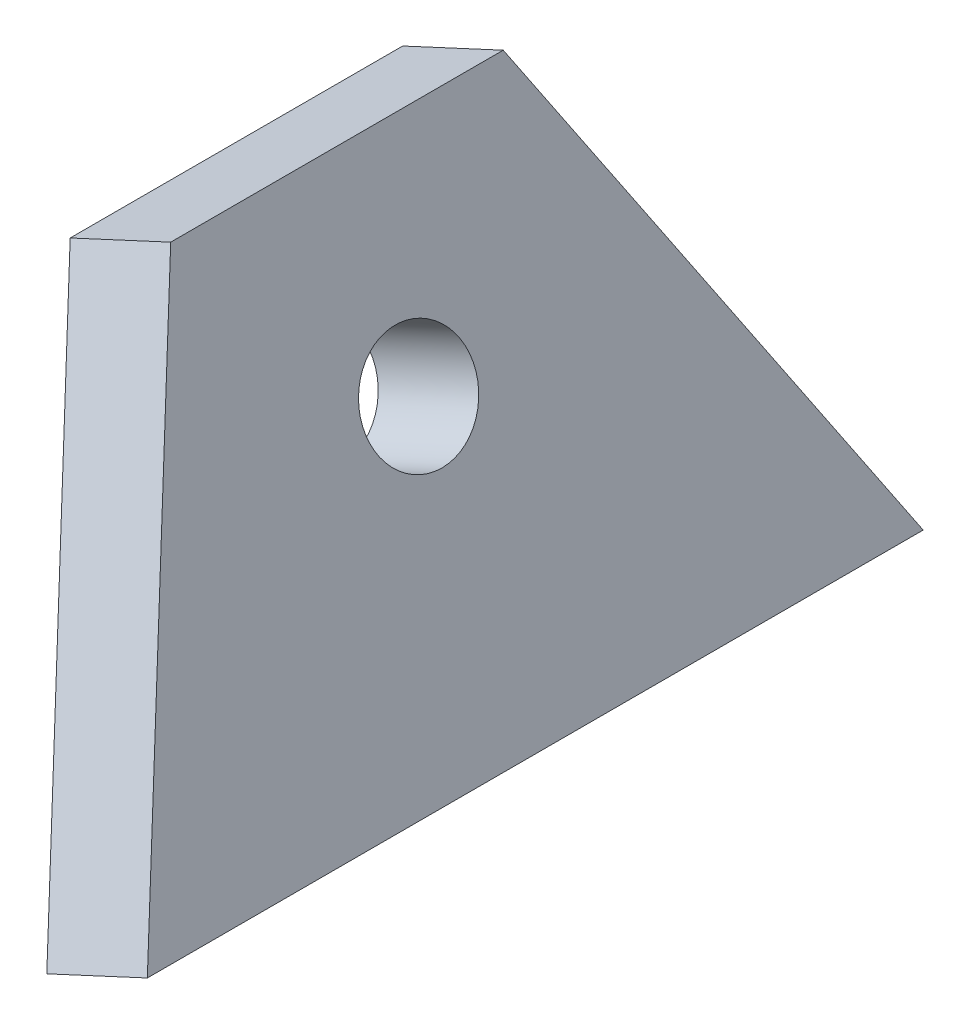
SolidWorks part; units mm, degrees
ref_plane "Alzado" through (0, 0, 0) normal (0, 0, 1) x (1, 0, 0)
ref_plane "Planta" through (0, 0, 0) normal (0, 1, 0) x (1, 0, 0)
ref_plane "Vista lateral" through (0, 0, 0) normal (1, 0, 0) x (0, 0, -1)
sketch3d "Sk_Plano_Yugo"
  point P0 (450.0041, 392.4955, 0)
  point P1 (450.0041, 392.4955, 10)
  point P2 (445.7944, 401.5663, 0)
ref_plane "Plano_Yugo" through (520.1314, 241.3899, 0) normal (-0.9071, -0.421, 0) x (0, 0, 1)
sketch "Sk_Yugo" plane through (520.1314, 241.3899, 0) normal (-0.9071, -0.421, 0) x (0, 0, 1)
  line L0 (-14, 229.5855) -> (14, 229.5855)
  line L1 (14, 229.5855) -> (6, 246.5855)
  line L2 (6, 246.5855) -> (-6, 246.5855)
  line L3 (-6, 246.5855) -> (-14, 229.5855)
extrude "Yugo" add sketch "Sk_Yugo" against normal blind 4
sketch3d "Sk_Ojo_cable"
  line L0 (418.3664, 458.2911, 0) -> (423.8088, 460.8169, 0)
  dimension "D1" = 6
sweep "Ojo_cable" cut path "Sk_Ojo_cable" parameters "D3"=4
